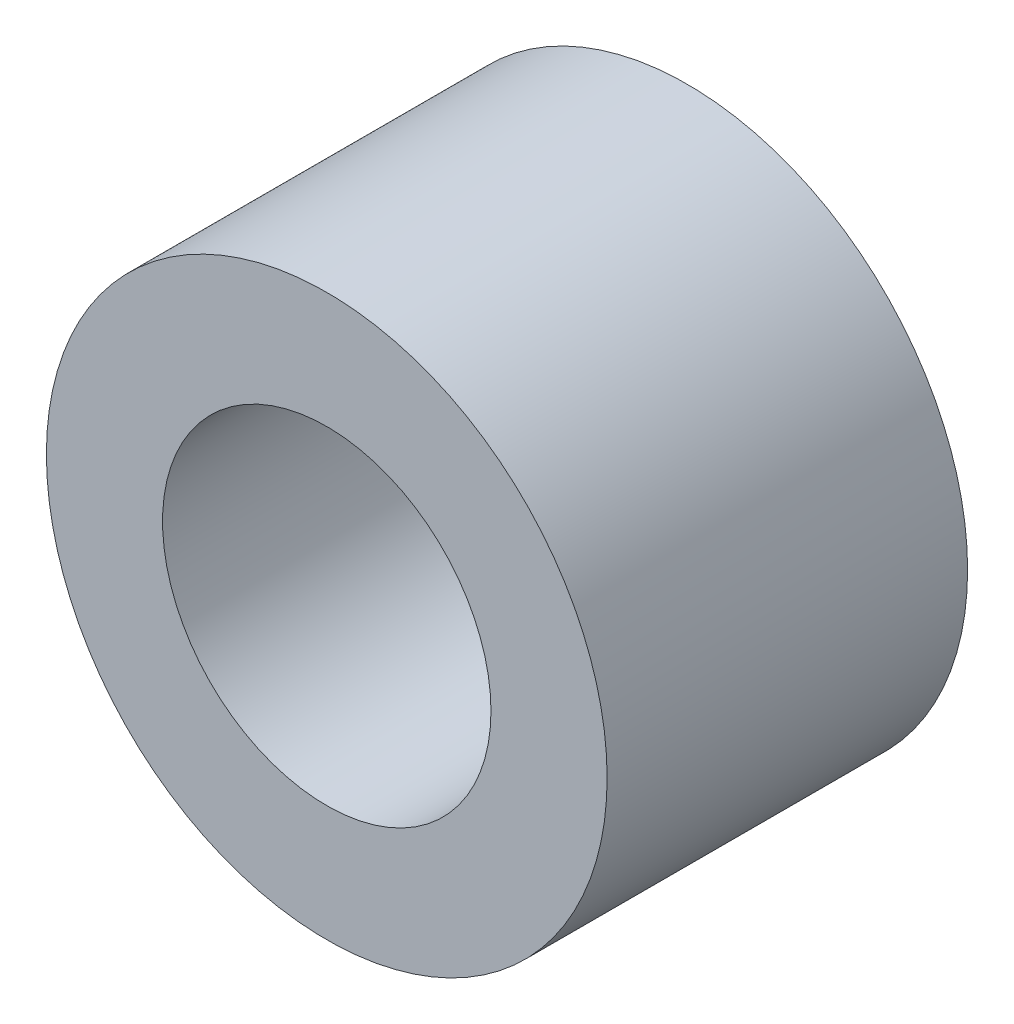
SolidWorks part; units mm, degrees
ref_plane "Front Plane" through (0, 0, 0) normal (0, 0, 1) x (1, 0, 0)
ref_plane "Top Plane" through (0, 0, 0) normal (0, 1, 0) x (1, 0, 0)
ref_plane "Right Plane" through (0, 0, 0) normal (1, 0, 0) x (0, 0, -1)
sketch "Sketch1" plane through (0, 0, 0) normal (0, 0, 1) x (1, 0, 0)
  circle A1 centre (138.3381, 85.5782) radius 4.1
  arc A4 (141.355, 81.2092) -> (135.3212, 89.9471) centre (138.3381, 85.5782) ccw
  arc A5 (135.3212, 89.9471) -> (141.355, 81.2092) centre (138.3381, 85.5782) ccw
extrude "Boss-Extrude1" add sketch "Sketch1" along normal up to surface (9 mm away)
sketch "Sketch3" plane through (0, 0, 0) normal (1, 0, 0) x (0, 0, -1)
  line L0 (-9, 85.5782) -> (0, 85.5782)
  line L1 (-9, 90.8876) -> (-9, 80.2688) construction
  line L2 (0, 80.2688) -> (0, 90.8876) construction
  dimension "D1" = 9
sketch "Sketch4" plane through (0, 0, 9) normal (0, 0, 1) x (1, 0, 0)
  circle A0 centre (138.3381, 85.5782) radius 5.3094
  circle A1 centre (138.3381, 85.5782) radius 7
extrude "Boss-Extrude2" add sketch "Sketch4" against normal blind 9
